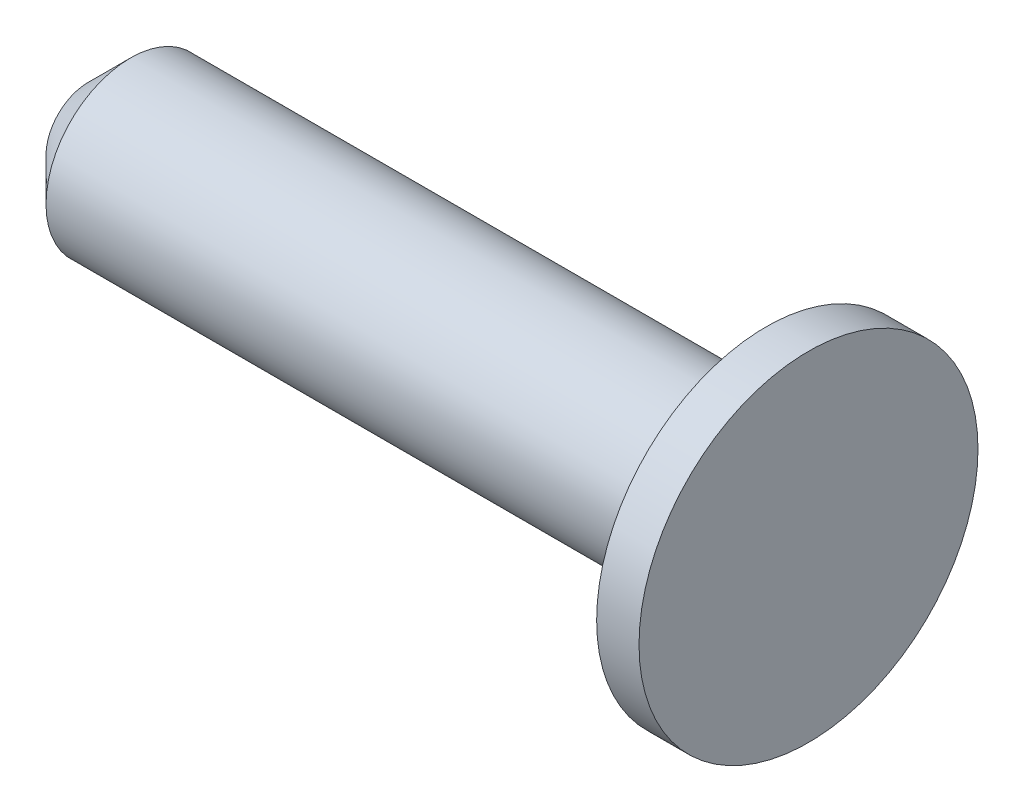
SolidWorks part; units mm, degrees
ref_plane "Front Plane" through (0, 0, 0) normal (0, 0, 1) x (1, 0, 0)
ref_plane "Top Plane" through (0, 0, 0) normal (0, 1, 0) x (1, 0, 0)
ref_plane "Right Plane" through (0, 0, 0) normal (1, 0, 0) x (0, 0, -1)
sketch "Sketch3" plane through (0, 0, 0) normal (0, 0, 1) x (1, 0, 0)
  line L0 (0, 0) -> (0, 1.995)
  line L1 (0, 1.995) -> (16, 1.995)
  line L2 (16, 1.995) -> (16, 4)
  line L3 (16, 4) -> (17, 4)
  line L4 (17, 4) -> (17, 0)
  line L5 (0, 0) -> (17, 0) construction
  line L6 (0, 0) -> (17, 0)
  dimension "D1" = 3.99
  dimension "D2" = 1
  dimension "D3" = 8
  dimension "D4" = 16
revolve "Revolve1" add sketch "Sketch3" angle 360 about L5
chamfer "Chamfer1" distance 1 angle 45 1 edges at (0, 0, 1.995)
